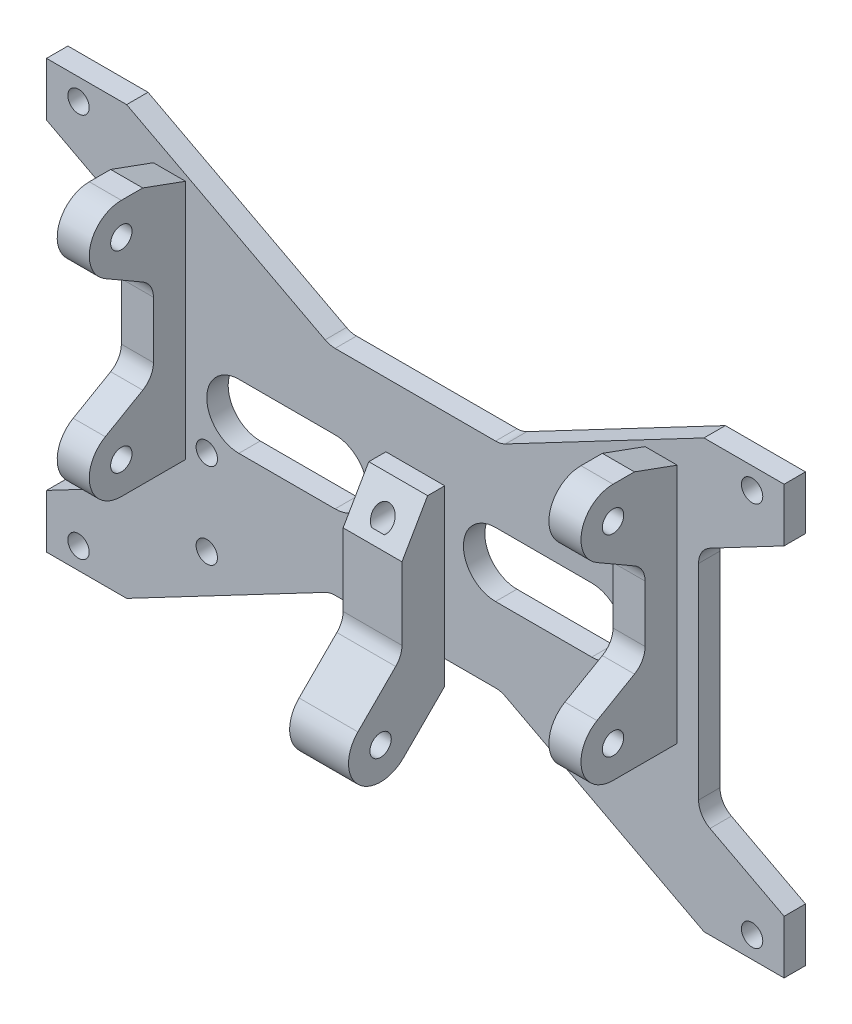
SolidWorks part; units mm, degrees
ref_plane "Front Plane" through (0, 0, 0) normal (0, 0, 1) x (1, 0, 0)
ref_plane "Top Plane" through (0, 0, 0) normal (0, 1, 0) x (1, 0, 0)
ref_plane "Right Plane" through (0, 0, 0) normal (1, 0, 0) x (0, 0, -1)
sketch "Sketch1" plane through (0, 0, 0) normal (0, 0, 1) x (1, 0, 0)
  line L0 (0, 0) -> (12.0707, 0) construction
  line L1 (0, 0) -> (0, 43.795) construction
  line L2 (-109.5248, -63.5) -> (109.5248, -63.5)
  line L3 (109.5248, -63.5) -> (109.5248, 63.5)
  line L4 (109.5248, 63.5) -> (-109.5248, 63.5)
  line L5 (-109.5248, 63.5) -> (-109.5248, -63.5)
  line L6 (-85.725, -63.5) -> (-25.4, -31.75)
  line L7 (-25.4, -31.75) -> (25.4, -31.75)
  line L8 (25.4, -31.75) -> (85.725, -63.5)
  line L9 (-109.5248, -47.625) -> (-84.1248, -34.2566)
  line L10 (-84.1248, -34.2566) -> (-84.1248, 34.2566)
  line L11 (-84.1248, 34.2566) -> (-109.5248, 47.625)
  line L12 (-85.725, 63.5) -> (-25.4, 31.75)
  line L13 (-25.4, 31.75) -> (25.4, 31.75)
  line L14 (25.4, 31.75) -> (85.725, 63.5)
  line L15 (109.5248, 47.625) -> (84.1248, 34.2566)
  line L16 (84.1248, 34.2566) -> (84.1248, -34.2566)
  line L17 (84.1248, -34.2566) -> (109.5248, -47.625)
  line L18 (-52.4002, 0) -> (-23.8252, 0) construction
  line L21 (-52.4002, 9.525) -> (-23.8252, 9.525)
  line L22 (-52.4002, -9.525) -> (-23.8252, -9.525)
  line L23 (23.8252, 0) -> (52.4002, 0) construction
  line L24 (23.8252, 9.525) -> (52.4002, 9.525)
  line L25 (23.8252, -9.525) -> (52.4002, -9.525)
  circle A0 centre (-100.0125, 57.15) radius 3.175
  circle A1 centre (100.0125, 57.15) radius 3.175
  circle A2 centre (-100.0125, -57.15) radius 3.175
  circle A3 centre (100.0125, -57.15) radius 3.175
  arc A6 (-52.4002, 9.525) -> (-52.4002, -9.525) centre (-52.4002, 0) ccw
  arc A7 (-23.8252, -9.525) -> (-23.8252, 9.525) centre (-23.8252, 0) ccw
  arc A8 (23.8252, 9.525) -> (23.8252, -9.525) centre (23.8252, 0) ccw
  arc A9 (52.4002, -9.525) -> (52.4002, 9.525) centre (52.4002, 0) ccw
  circle A10 centre (0, -22.225) radius 3.175
  circle A11 centre (0, 4.7752) radius 3.175
  circle A12 centre (-73.025, 38.1) radius 3.175
  circle A13 centre (-73.025, 0) radius 3.175
  circle A14 centre (73.025, 0) radius 3.175
  circle A15 centre (73.025, 38.1) radius 3.175
  circle A16 centre (-61.9252, -14.1732) radius 3.175
  circle A17 centre (-61.9252, -39.5732) radius 3.175
  point P34 (-38.1127, 0)
  point P39 (38.1127, 0)
  dimension "D1" = 6.35
  dimension "D16" = 6.35
  dimension "D13" = 6.35
  dimension "D21" = 6.35
  dimension "D2" = 200.025
  dimension "D3" = 114.3
  dimension "D4" = 219.0496
  dimension "D5" = 127
  dimension "D6" = 171.45
  dimension "D7" = 31.75
  dimension "D8" = 95.25
  dimension "D9" = 25.4
  dimension "D10" = 50.8
  dimension "D11" = 19.05
  dimension "D12" = 28.575
  dimension "D14" = 38.1
  dimension "D15" = 4.7752
  dimension "D17" = 22.225
  dimension "D18" = 23.8252
  dimension "D19" = 38.1
  dimension "D20" = 73.025
  dimension "D22" = 25.4
  dimension "D23" = 14.1732
  dimension "D24" = 61.9252
sketch "Sketch2" plane through (0, 0, 0) normal (0, 0, 1) x (1, 0, 0)
  line L0 (-25.4, -31.75) -> (25.4, -31.75) construction
  line L1 (-85.725, -63.5) -> (-25.4, -31.75) construction
  line L2 (-109.5248, -63.5) -> (109.5248, -63.5) construction
  line L3 (84.1248, -34.2566) -> (109.5248, -47.625) construction
  line L4 (109.5248, 47.625) -> (84.1248, 34.2566) construction
  line L5 (84.1248, 34.2566) -> (84.1248, -34.2566) construction
  line L6 (109.5248, -63.5) -> (109.5248, 63.5) construction
  line L7 (25.4, 31.75) -> (85.725, 63.5) construction
  line L8 (-25.4, 31.75) -> (25.4, 31.75) construction
  line L9 (-85.725, 63.5) -> (-25.4, 31.75) construction
  line L10 (109.5248, 63.5) -> (-109.5248, 63.5) construction
  line L11 (-84.1248, 34.2566) -> (-109.5248, 47.625) construction
  line L12 (-109.5248, 63.5) -> (-109.5248, -63.5) construction
  line L13 (-84.1248, -34.2566) -> (-84.1248, 34.2566) construction
  line L14 (-109.5248, -47.625) -> (-84.1248, -34.2566) construction
  line L15 (25.4, -31.75) -> (85.725, -63.5) construction
  line L16 (-25.4, -31.75) -> (25.4, -31.75)
  line L17 (-85.725, -63.5) -> (-25.4, -31.75)
  line L18 (-109.5248, -63.5) -> (-85.725, -63.5)
  line L19 (84.1248, -34.2566) -> (109.5248, -47.625)
  line L20 (109.5248, 47.625) -> (84.1248, 34.2566)
  line L21 (84.1248, 34.2566) -> (84.1248, -34.2566)
  line L22 (109.5248, -63.5) -> (109.5248, -47.625)
  line L23 (25.4, 31.75) -> (85.725, 63.5)
  line L24 (-25.4, 31.75) -> (25.4, 31.75)
  line L25 (-85.725, 63.5) -> (-25.4, 31.75)
  line L26 (109.5248, 63.5) -> (85.725, 63.5)
  line L27 (-84.1248, 34.2566) -> (-109.5248, 47.625)
  line L28 (-109.5248, 63.5) -> (-109.5248, 47.625)
  line L29 (-84.1248, -34.2566) -> (-84.1248, 34.2566)
  line L30 (-109.5248, -47.625) -> (-84.1248, -34.2566)
  line L31 (25.4, -31.75) -> (85.725, -63.5)
  line L32 (-109.5248, -47.625) -> (-109.5248, -63.5)
  line L33 (-85.725, 63.5) -> (-109.5248, 63.5)
  line L34 (85.725, -63.5) -> (109.5248, -63.5)
  line L35 (109.5248, 47.625) -> (109.5248, 63.5)
  line L38 (-52.4002, -9.525) -> (-23.8252, -9.525) construction
  line L39 (-52.4002, 9.525) -> (-23.8252, 9.525) construction
  line L40 (23.8252, -9.525) -> (52.4002, -9.525) construction
  line L41 (23.8252, 9.525) -> (52.4002, 9.525) construction
  line L42 (-52.4002, -9.525) -> (-23.8252, -9.525)
  line L43 (-52.4002, 9.525) -> (-23.8252, 9.525)
  line L44 (23.8252, -9.525) -> (52.4002, -9.525)
  line L45 (23.8252, 9.525) -> (52.4002, 9.525)
  circle A0 centre (100.0125, 57.15) radius 3.175 construction
  circle A1 centre (-100.0125, -57.15) radius 3.175 construction
  circle A2 centre (-100.0125, 57.15) radius 3.175 construction
  circle A3 centre (100.0125, -57.15) radius 3.175 construction
  circle A4 centre (100.0125, 57.15) radius 3.175
  circle A5 centre (-100.0125, -57.15) radius 3.175
  circle A6 centre (-100.0125, 57.15) radius 3.175
  circle A7 centre (100.0125, -57.15) radius 3.175
  arc A10 (-23.8252, -9.525) -> (-23.8252, 9.525) centre (-23.8252, 0) ccw construction
  arc A11 (-52.4002, 9.525) -> (-52.4002, -9.525) centre (-52.4002, 0) ccw construction
  arc A12 (52.4002, -9.525) -> (52.4002, 9.525) centre (52.4002, 0) ccw construction
  arc A13 (23.8252, 9.525) -> (23.8252, -9.525) centre (23.8252, 0) ccw construction
  arc A16 (-23.8252, -9.525) -> (-23.8252, 9.525) centre (-23.8252, 0) ccw
  arc A17 (-52.4002, 9.525) -> (-52.4002, -9.525) centre (-52.4002, 0) ccw
  arc A18 (52.4002, -9.525) -> (52.4002, 9.525) centre (52.4002, 0) ccw
  arc A19 (23.8252, 9.525) -> (23.8252, -9.525) centre (23.8252, 0) ccw
extrude "Boss-Extrude1" add sketch "Sketch2" along normal blind 6.35
fillet "Fillet1" radius 6.35 8 edges at (-25.4, -31.75, 3.175) (25.4, -31.75, 3.175) (84.1248, -34.2566, 3.175) (84.1248, 34.2566, 3.175) (25.4, 31.75, 3.175) (-25.4, 31.75, 3.175) (-84.1248, 34.2566, 3.175) (-84.1248, -34.2566, 3.175)
sketch "Sketch5" plane through (0, 0, 0) normal (1, 0, 0) x (0, 0, -1)
  line L0 (-6.35, 57.15) -> (-25.4, 57.15)
  line L1 (-6.35, -30.4229) -> (-6.35, 30.4229) construction
  line L2 (-30.1625, 39.3761) -> (-15.875, 31.1272)
  line L3 (-15.875, 31.1272) -> (-15.875, 6.9728)
  line L4 (-15.875, 6.9728) -> (-30.1625, -1.2761)
  line L5 (-25.4, -19.05) -> (-6.35, -19.05)
  line L6 (-6.35, -63.5) -> (-6.35, -47.625) construction
  line L7 (-6.35, -19.05) -> (-6.35, 57.15)
  line L8 (-15.875, 19.05) -> (-41.5171, 19.05) construction
  arc A0 (-25.4, 57.15) -> (-30.1625, 39.3761) centre (-25.4, 47.625) ccw
  arc A1 (-30.1625, -1.2761) -> (-25.4, -19.05) centre (-25.4, -9.525) ccw
  circle A2 centre (-25.4, 47.625) radius 3.175
  circle A3 centre (-25.4, -9.525) radius 3.175
  dimension "D2" = 9.525
  dimension "D7" = 6.35
  dimension "D1" = 57.15
  dimension "D3" = 25.4
  dimension "D4" = 15.875
  dimension "D5" = 76.2
  dimension "D6" = 30
sketch "Sketch6" plane through (0, 0, 0) normal (1, 0, 0) x (0, 0, -1)
  line L0 (-6.35, -19.05) -> (-6.35, 57.15) construction
  line L1 (-6.35, 57.15) -> (-25.4, 57.15) construction
  line L2 (-30.1625, 39.3761) -> (-15.875, 31.1272) construction
  line L3 (-15.875, 31.1272) -> (-15.875, 6.9728) construction
  line L4 (-15.875, 6.9728) -> (-30.1625, -1.2761) construction
  line L5 (-25.4, -19.05) -> (-6.35, -19.05) construction
  line L6 (-6.35, -19.05) -> (-6.35, 57.15)
  line L7 (-6.35, 57.15) -> (-25.4, 57.15)
  line L8 (-30.1625, 39.3761) -> (-15.875, 31.1272)
  line L9 (-15.875, 31.1272) -> (-15.875, 6.9728)
  line L10 (-15.875, 6.9728) -> (-30.1625, -1.2761)
  line L11 (-25.4, -19.05) -> (-6.35, -19.05)
  arc A0 (-25.4, 57.15) -> (-30.1625, 39.3761) centre (-25.4, 47.625) ccw construction
  arc A1 (-30.1625, -1.2761) -> (-25.4, -19.05) centre (-25.4, -9.525) ccw construction
  circle A2 centre (-25.4, -9.525) radius 3.175 construction
  circle A3 centre (-25.4, 47.625) radius 3.175 construction
  arc A4 (-25.4, 57.15) -> (-30.1625, 39.3761) centre (-25.4, 47.625) ccw
  arc A5 (-30.1625, -1.2761) -> (-25.4, -19.05) centre (-25.4, -9.525) ccw
  circle A6 centre (-25.4, -9.525) radius 3.175
  circle A7 centre (-25.4, 47.625) radius 3.175
extrude "Boss-Extrude3" add sketch "Sketch6" against normal blind 9.525 from offset 77.7748 separate body
sketch "Sketch7" plane through (0, 0, 0) normal (1, 0, 0) x (0, 0, -1)
  line L0 (-6.35, -19.05) -> (-6.35, 57.15) construction
  line L1 (-6.35, 57.15) -> (-25.4, 57.15) construction
  line L2 (-30.1625, 39.3761) -> (-15.875, 31.1272) construction
  line L3 (-15.875, 31.1272) -> (-15.875, 6.9728) construction
  line L4 (-15.875, 6.9728) -> (-30.1625, -1.2761) construction
  line L5 (-25.4, -19.05) -> (-6.35, -19.05) construction
  line L6 (-6.35, -19.05) -> (-6.35, 57.15)
  line L7 (-6.35, 57.15) -> (-25.4, 57.15)
  line L8 (-30.1625, 39.3761) -> (-15.875, 31.1272)
  line L9 (-15.875, 31.1272) -> (-15.875, 6.9728)
  line L10 (-15.875, 6.9728) -> (-30.1625, -1.2761)
  line L11 (-25.4, -19.05) -> (-6.35, -19.05)
  arc A0 (-25.4, 57.15) -> (-30.1625, 39.3761) centre (-25.4, 47.625) ccw construction
  arc A1 (-30.1625, -1.2761) -> (-25.4, -19.05) centre (-25.4, -9.525) ccw construction
  arc A2 (-25.4, 57.15) -> (-30.1625, 39.3761) centre (-25.4, 47.625) ccw
  arc A3 (-30.1625, -1.2761) -> (-25.4, -19.05) centre (-25.4, -9.525) ccw
  circle A4 centre (-25.4, 47.625) radius 3.175 construction
  circle A5 centre (-25.4, -9.525) radius 3.175 construction
  circle A6 centre (-25.4, 47.625) radius 3.175
  circle A7 centre (-25.4, -9.525) radius 3.175
extrude "Boss-Extrude4" add sketch "Sketch7" along normal blind 9.525 from offset 77.7748 separate body
fillet "Fillet4" radius 6.35 2 edges at (-73.0123, 6.9728, 15.875) (-73.0123, 31.1272, 15.875)
fillet "Fillet5" radius 6.35 2 edges at (73.0123, 31.1272, 15.875) (73.0123, 6.9728, 15.875)
sketch "Sketch8" plane through (0, 0, 0) normal (1, 0, 0) x (0, 0, -1)
  line L0 (-6.35, 12.7) -> (-19.05, 12.7)
  line L1 (-6.35, -30.4229) -> (-6.35, 30.4229) construction
  line L2 (-19.05, 12.7) -> (-19.05, -24.6296)
  line L3 (-19.05, -24.6296) -> (-32.1352, -37.7148)
  line L4 (-18.6648, -51.1852) -> (-6.35, -38.8704)
  line L5 (-6.35, -63.5) -> (-6.35, -47.625) construction
  line L6 (-6.35, -38.8704) -> (-6.35, 12.7)
  arc A0 (-32.1352, -37.7148) -> (-18.6648, -51.1852) centre (-25.4, -44.45) ccw
  circle A1 centre (-25.4, -44.45) radius 3.175
  circle A2 centre (-25.4, -44.45) radius 9.525 construction
  dimension "D3" = 9.525
  dimension "D5" = 6.35
  dimension "D1" = 25.4
  dimension "D2" = 12.7
  dimension "D4" = 45
  dimension "D6" = 12.7
  dimension "D7" = 44.45
extrude "Boss-Extrude5" add sketch "Sketch8" along normal mid plane 17.4752 separate body
chamfer "Chamfer2" distance 7.62 angle 60 1 edges at (0, 12.7, 19.05)
chamfer "Chamfer3" distance 12.7 angle 20 1 edges at (-73.0123, 57.15, 6.35)
chamfer "Chamfer4" distance 12.7 angle 20 1 edges at (73.0123, 57.15, 6.35)
sketch "Sketch9" plane through (0, 0, 0) normal (1, 0, 0) x (0, 0, -1)
  circle A1 centre (-25.4, -44.45) radius 11.1125
  dimension "D1" = 22.225
extrude "Cut-Extrude1" [suppressed] cut sketch "Sketch9" against normal mid plane 9.525
sketch "Sketch10" plane through (0, 0, 0) normal (0, 0, 1) x (1, 0, 0)
  circle A0 centre (-73.025, 38.1) radius 3.175 construction
  circle A1 centre (-73.025, 0) radius 3.175 construction
  circle A2 centre (73.025, 38.1) radius 3.175 construction
  circle A3 centre (73.025, 0) radius 3.175 construction
  circle A4 centre (-73.025, 38.1) radius 3.175
  circle A5 centre (-73.025, 0) radius 3.175
  circle A6 centre (73.025, 38.1) radius 3.175
  circle A7 centre (73.025, 0) radius 3.175
  circle A8 centre (-61.9252, -39.5732) radius 3.175 construction
  circle A9 centre (-61.9252, -14.1732) radius 3.175 construction
  circle A10 centre (-61.9252, -39.5732) radius 3.175
  circle A11 centre (-61.9252, -14.1732) radius 3.175
extrude "Cut-Extrude2" cut sketch "Sketch10" along normal blind 22.225
sketch "Sketch11" plane through (0, 0, 0) normal (0, 0, 1) x (1, 0, 0)
  circle A0 centre (0, -22.225) radius 3.175 construction
  circle A1 centre (0, 4.7752) radius 3.175 construction
  circle A2 centre (0, -22.225) radius 3.175
  circle A3 centre (0, 4.7752) radius 3.175
extrude "Cut-Extrude3" cut sketch "Sketch11" along normal blind 17.4752
chamfer "Chamfer5" distance 1.778 angle 59 2 edges at (76.2, 38.1, 22.225) (76.2, 0, 22.225)
fillet "Fillet6" radius 6.35 1 edges at (0, -24.6296, 19.05)
